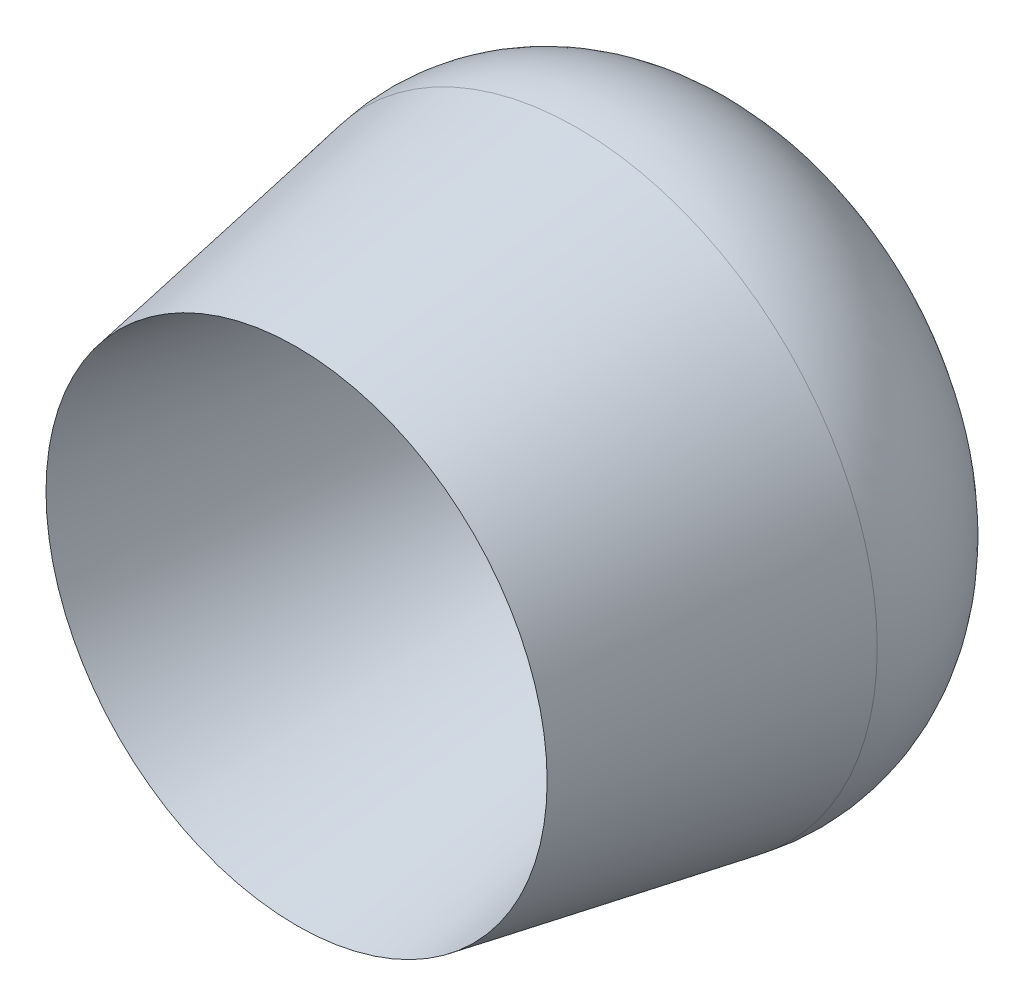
SolidWorks part; units mm, degrees
ref_plane "Front Plane" through (0, 0, 0) normal (0, 0, 1) x (1, 0, 0)
ref_plane "Top Plane" through (0, 0, 0) normal (0, 1, 0) x (1, 0, 0)
ref_plane "Right Plane" through (0, 0, 0) normal (1, 0, 0) x (0, 0, -1)
sketch "Sketch1" plane through (0, 0, 0) normal (0, 0, 1) x (1, 0, 0)
  circle A0 centre (0, 0) radius 1
  circle A1 centre (0, 0) radius 2
  dimension "D1" = 2
  dimension "D2" = 1
extrude "Boss-Extrude1" add sketch "Sketch1" along normal blind 5 draft 10
fillet "Fillet1" radius 1 1 edges at (2, 0, 0)
